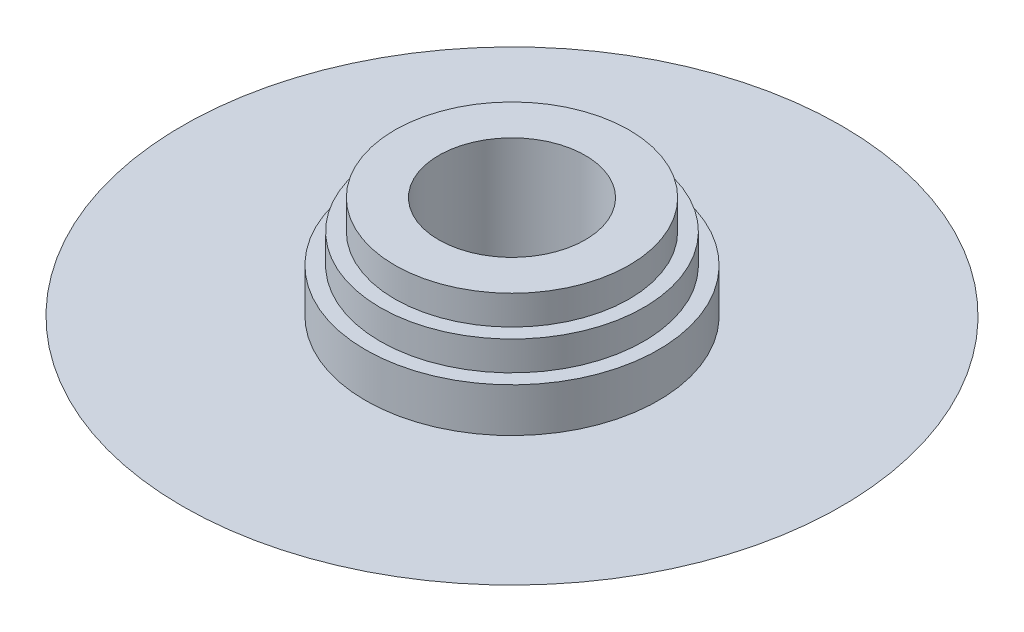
SolidWorks part; units mm, degrees
ref_plane "Plan1" through (0, 0, 0) normal (0, 0, 1) x (1, 0, 0)
ref_plane "Plan2" through (0, 0, 0) normal (0, 1, 0) x (1, 0, 0)
ref_plane "Plan3" through (0, 0, 0) normal (1, 0, 0) x (0, 0, -1)
sketch "Esquisse1" plane through (0, 0, 0) normal (0, 0, 1) x (1, 0, 0)
  line L0 (0, 0) -> (-22.5, 7.5)
  line L1 (-22.5, 7.5) -> (0, 7.5)
  line L2 (0, 7.5) -> (0, 0)
  line L3 (0, -7) -> (0, 25) construction
  dimension "D1" = 22.5
  dimension "D2" = 7.5
revolve "Base-Révolution" add sketch "Esquisse1" angle 360 about L3
ref_plane "Plan4" through (0, 4.5, 0) normal (0, 1, 0) x (-1, 0, 0)
sketch "Esquisse2" plane through (0, 4.5, 0) normal (0, 1, 0) x (-1, 0, 0)
  circle A0 centre (0, 0) radius 13.5
  dimension "D1" = 27
extrude "Enlèv. mat.-Extru.1" cut sketch "Esquisse2" against normal blind 10
sketch "Esquisse4"
  circle A0 centre (0, 0) radius 10
  dimension "D1" = 20
extrude "Enlèv. mat.-Extru.3" cut sketch "Esquisse3" along normal through all
sketch "Esquisse3" plane through (0, 4.5, 0) normal (0, 1, 0) x (-1, 0, 0)
  circle A0 centre (0, 0) radius 5
  dimension "D1" = 10
extrude "Boss.-Extru.1" add sketch "Esquisse4" along normal blind 3
sketch "Esquisse5" plane through (0, 10.5, 0) normal (0, 1, 0) x (-1, 0, 0)
  circle A0 centre (0, 0) radius 9
  dimension "D1" = 18
extrude "Boss.-Extru.2" add sketch "Esquisse5" along normal blind 2
sketch "Esquisse6" plane through (0, 12.5, 0) normal (0, 1, 0) x (-1, 0, 0)
  circle A0 centre (0, 0) radius 8
  dimension "D1" = 16
extrude "Boss.-Extru.3" add sketch "Esquisse6" along normal blind 2
